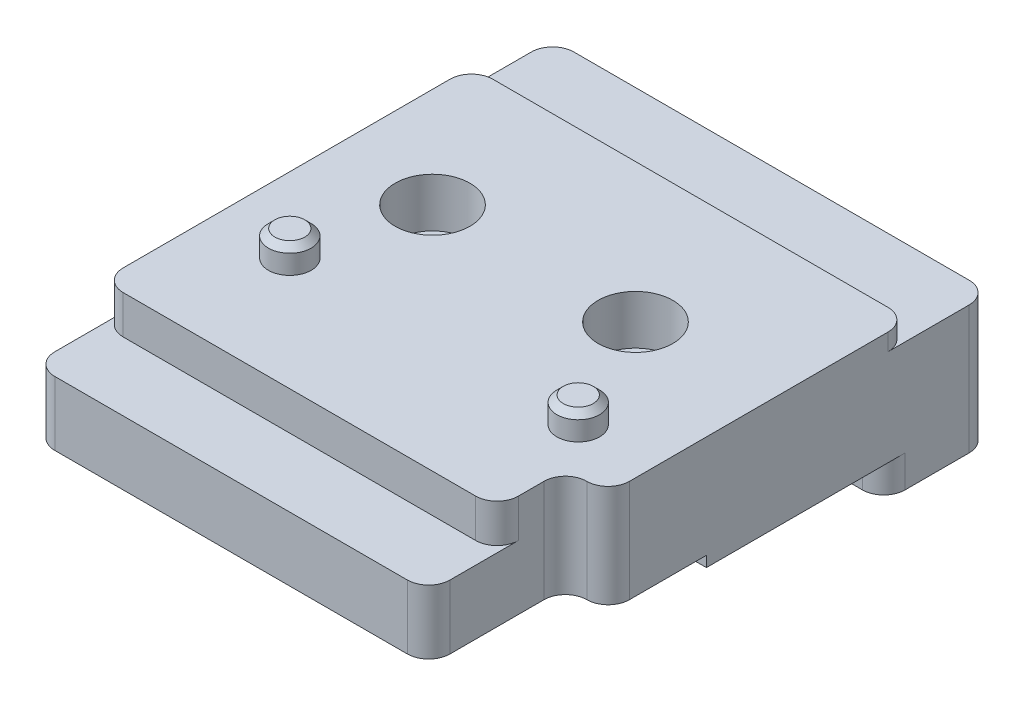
SolidWorks part; units mm, degrees
ref_plane "前视基准面" through (0, 0, 0) normal (0, 0, 1) x (1, 0, 0)
ref_plane "上视基准面" through (0, 0, 0) normal (0, 1, 0) x (1, 0, 0)
ref_plane "右视基准面" through (0, 0, 0) normal (1, 0, 0) x (0, 0, -1)
sketch "草图1" plane through (0, 0, 0) normal (0, 1, 0) x (1, 0, 0)
  line L0 (0, 0) -> (0, 11.17) construction
  line L1 (-12.75, 2.5) -> (-2.5, 2.5)
  line L2 (-12.75, 2.5) -> (-12.75, -2.5)
  line L3 (-12.75, -2.5) -> (12.75, -2.5)
  line L4 (12.75, 2.5) -> (12.75, -2.5)
  line L5 (-12.75, 2.5) -> (12.75, -2.5) construction
  line L6 (-12.75, -2.5) -> (12.75, 2.5) construction
  line L7 (2.5, 2.5) -> (12.75, 2.5)
  line L9 (-2.5, 2.5) -> (-2.5, 7)
  line L10 (-2.5, 7) -> (2.5, 7)
  line L11 (2.5, 2.5) -> (2.5, 7)
  point P0 (0, 0)
  dimension "D1" = 25.5
  dimension "D2" = 5
  dimension "D3" = 2.5
  dimension "D4" = 2.5
  dimension "D5" = 4.5
extrude "凸台-拉伸1" add sketch "草图1" along normal blind 2.5
sketch "草图3" plane through (0, 0, 0) normal (0, -1, 0) x (1, 0, 0)
  line L0 (2.5, -7) -> (-2.5, -7) construction
  line L1 (-2.5, -7) -> (-2.5, -2.5) construction
  circle A0 centre (0, -5) radius 1.15
  dimension "D1" = 2.3
  dimension "D3" = 2.5
  dimension "D2" = 2
extrude "切除-拉伸2" cut sketch "草图3" against normal through all
sketch "草图4" plane through (0, 0, 2.5) normal (0, 0, 1) x (1, 0, 0)
  line L4 (-12.75, 0) -> (12.75, 0)
  line L5 (12.75, 0) -> (12.75, 2.5)
  line L6 (12.75, 2.5) -> (-12.75, 2.5)
  line L7 (-12.75, 2.5) -> (-12.75, 0)
  line L8 (-12.75, 0) -> (12.75, 0)
  line L9 (12.75, 0) -> (12.75, 2.5)
  line L10 (12.75, 2.5) -> (-12.75, 2.5)
  line L11 (-12.75, 2.5) -> (-12.75, 0)
  dimension "D1" = 0
extrude "凸台-拉伸2" add sketch "草图4" along normal blind 16.7
sketch "草图5" plane through (0, 0, -2.5) normal (0, 0, -1) x (-1, 0, 0)
  line L0 (2.5, 2.5) -> (12.75, 2.5) construction
  line L1 (12.75, 0) -> (13.75, 0)
  line L2 (12.75, 0) -> (12.75, 2.5)
  line L3 (12.75, 2.5) -> (13.75, 2.5)
  line L4 (13.75, 0) -> (13.75, 2.5)
  line L5 (-12.75, 0) -> (-13.75, 0)
  line L6 (-12.75, 0) -> (-12.75, 2.5)
  line L7 (-12.75, 2.5) -> (-13.75, 2.5)
  line L8 (-13.75, 0) -> (-13.75, 2.5)
  line L9 (-12.75, 2.5) -> (-2.5, 2.5) construction
  dimension "D1" = 1
  dimension "D2" = 1
extrude "凸台-拉伸3" add sketch "草图5" against normal up to surface (21.7 mm away)
sketch "草图6" plane through (0, 0, 0) normal (0, -1, 0) x (1, 0, 0)
  line L1 (-13.75, -2.5) -> (-12.45, -2.5)
  line L2 (-13.75, -2.5) -> (-13.75, 1.7905)
  line L3 (-13.75, 1.7905) -> (-12.45, 1.7905)
  line L4 (-12.45, -2.5) -> (-12.45, 1.7905)
extrude "切除-拉伸3" cut sketch "草图6" against normal through all
sketch "草图7" plane through (0, 2.5, 0) normal (0, 1, 0) x (1, 0, 0)
  line L13 (13.75, 2.5) -> (2.5, 2.5)
  line L14 (2.5, 2.5) -> (2.5, 7)
  line L15 (2.5, 7) -> (-2.5, 7)
  line L16 (-2.5, 7) -> (-2.5, 2.5)
  line L17 (-2.5, 2.5) -> (-12.45, 2.5)
  line L18 (-12.45, 2.5) -> (-12.45, -1.7905)
  line L19 (-12.45, -1.7905) -> (-13.75, -1.7905)
  line L20 (-13.75, -1.7905) -> (-13.75, -19.2)
  line L21 (-13.75, -19.2) -> (13.75, -19.2)
  line L22 (13.75, -19.2) -> (13.75, 2.5)
  line L25 (13.75, 2.5) -> (2.5, 2.5)
  line L26 (2.5, 2.5) -> (2.5, 7)
  line L27 (2.5, 7) -> (-2.5, 7)
  line L28 (-2.5, 7) -> (-2.5, 2.5)
  line L29 (-2.5, 2.5) -> (-12.45, 2.5)
  line L30 (-12.45, 2.5) -> (-12.45, -1.7905)
  line L31 (-12.45, -1.7905) -> (-13.75, -1.7905)
  line L32 (-13.75, -1.7905) -> (-13.75, -19.2)
  line L33 (-13.75, -19.2) -> (13.75, -19.2)
  line L34 (13.75, -19.2) -> (13.75, 2.5)
  circle A0 centre (0, 5) radius 1.15 construction
  circle A1 centre (0, 5) radius 1.15
  dimension "D1" = 0
extrude "凸台-拉伸4" add sketch "草图7" along normal blind 2.1
sketch "草图11" plane through (0, 0, 0) normal (0, -1, 0) x (-1, 0, 0)
  line L0 (-13.75, -19.2) -> (-13.75, 2.5) construction
  line L1 (13.75, -19.2) -> (-13.75, -19.2)
  line L2 (13.75, -19.2) -> (13.75, -8.2)
  line L3 (13.75, -8.2) -> (-13.75, -8.2)
  line L4 (-13.75, -19.2) -> (-13.75, -8.2)
  dimension "D1" = 11
extrude "切除-拉伸6" cut sketch "草图11" against normal blind 2
sketch "草图12" plane through (0, 2, 0) normal (0, -1, 0) x (1, 0, 0)
  line L0 (2.6435, 10.2047) -> (-5.9829, 18.8314)
  line L1 (-6.69, 18.8314) -> (-7.6092, 17.9122)
  line L2 (-7.6092, 17.2051) -> (1.0171, 8.5784)
  line L3 (1.7242, 8.5784) -> (2.6435, 9.4976)
  line L16 (12.4735, 10.2047) -> (3.8471, 18.8314)
  line L17 (3.14, 18.8314) -> (2.2208, 17.9122)
  line L18 (2.2208, 17.2051) -> (10.8471, 8.5784)
  line L19 (11.5542, 8.5784) -> (12.4735, 9.4976)
  arc A0 (-5.9829, 18.8314) -> (-6.69, 18.8314) centre (-6.3365, 18.4779) ccw
  arc A1 (-7.6092, 17.2051) -> (-7.6092, 17.9122) centre (-7.2557, 17.5587) cw
  arc A2 (2.6435, 9.4976) -> (2.6435, 10.2047) centre (2.2899, 9.8512) ccw
  arc A3 (1.7242, 8.5784) -> (1.0171, 8.5784) centre (1.3707, 8.9319) cw
  arc A4 (3.8471, 18.8314) -> (3.14, 18.8314) centre (3.4935, 18.4779) ccw
  arc A5 (2.2208, 17.2051) -> (2.2208, 17.9122) centre (2.5743, 17.5587) cw
  arc A6 (12.4735, 9.4976) -> (12.4735, 10.2047) centre (12.1199, 9.8512) ccw
  arc A7 (11.5542, 8.5784) -> (10.8471, 8.5784) centre (11.2007, 8.9319) cw
sketch "草图13" plane through (0, 0, 0) normal (0, -1, 0) x (1, 0, 0)
  line L1 (2.5, -7) -> (-2.5, -7)
  line L2 (2.5, -7) -> (2.5, -2.5)
  line L3 (2.5, -2.5) -> (-2.5, -2.5)
  line L4 (-2.5, -7) -> (-2.5, -2.5)
extrude "切除-拉伸8" cut sketch "草图13" against normal blind 2
fillet "圆角2" radius 2 4 edges at (-2.5, 3.3, -2.5) (2.5, 3.3, -2.5) (-2.5, 3.3, -7) (2.5, 3.3, -7)
fillet "圆角3" radius 1 1 edges at (13.75, 3.3, 19.2)
sketch "草图15" plane through (0, 2, 0) normal (0, -1, 0) x (1, 0, 0)
  line L0 (13.75, 8.2) -> (13.75, 18.2) construction
  line L1 (12.75, 19.2) -> (-13.75, 19.2) construction
  circle A0 centre (11.05, 16.5) radius 1.15
  dimension "D1" = 2.3
  dimension "D2" = 2.7
  dimension "D3" = 2.7
extrude "切除-拉伸9" cut sketch "草图15" against normal through all
sketch "草图16" plane through (0, 4.6, 0) normal (0, 1, 0) x (1, 0, 0)
  line L0 (0, 5) -> (0, -20.6564) construction
  line L1 (-5, -19.2) -> (5, -19.2) construction
  line L2 (-13.75, -19.2) -> (12.75, -19.2) construction
  line L3 (-5, -17.7) -> (5, -17.7)
  line L4 (-5, -20.7) -> (5, -20.7)
  arc A0 (-5, -17.7) -> (-5, -20.7) centre (-5, -19.2) ccw
  arc A1 (5, -20.7) -> (5, -17.7) centre (5, -19.2) ccw
  point P8 (0, -19.2)
  dimension "D1" = 1.5
  dimension "D2" = 5
extrude "切除-拉伸10" cut sketch "草图16" against normal blind 1
sketch "草图18" plane through (0, 2, 0) normal (0, -1, 0) x (1, 0, 0)
  line L4 (-2.5, -4.5) -> (-2.5, -5)
  line L5 (-0.5, -7) -> (0.5, -7)
  line L6 (2.5, -5) -> (2.5, -4.5)
  line L7 (4.5, -2.5) -> (-4.5, -2.5)
  line L8 (-2.5, -4.5) -> (-2.5, -5)
  line L9 (-0.5, -7) -> (0.5, -7)
  line L10 (2.5, -5) -> (2.5, -4.5)
  line L11 (4.5, -2.5) -> (-4.5, -2.5)
  arc A4 (-2.5, -5) -> (-0.5, -7) centre (-0.5, -5) ccw
  arc A5 (0.5, -7) -> (2.5, -5) centre (0.5, -5) ccw
  arc A6 (4.5, -2.5) -> (2.5, -4.5) centre (4.5, -4.5) ccw
  arc A7 (-2.5, -4.5) -> (-4.5, -2.5) centre (-4.5, -4.5) ccw
  arc A8 (-2.5, -5) -> (-0.5, -7) centre (-0.5, -5) ccw
  arc A9 (0.5, -7) -> (2.5, -5) centre (0.5, -5) ccw
  arc A10 (4.5, -2.5) -> (2.5, -4.5) centre (4.5, -4.5) ccw
  arc A11 (-2.5, -4.5) -> (-4.5, -2.5) centre (-4.5, -4.5) ccw
  dimension "D1" = 0
extrude "切除-拉伸11" cut sketch "草图18" against normal through all
extrude "切除-拉伸12" cut sketch "草图12" against normal blind 1
sketch "草图19" plane through (0, 0, 0) normal (0, -1, 0) x (1, 0, 0)
  line L0 (13.75, -2.5) -> (-12.45, -2.5) construction
  line L1 (-13.75, 19.2) -> (-8.75, 19.2)
  line L2 (-13.75, 19.2) -> (-13.75, -2.5)
  line L3 (-13.75, -2.5) -> (-8.75, -2.5)
  line L4 (-8.75, 19.2) -> (-8.75, -2.5)
  dimension "D1" = 5
extrude "切除-拉伸13" cut sketch "草图19" against normal through all
sketch "草图24" plane through (0, 2, 0) normal (0, -1, 0) x (1, 0, 0)
  line L4 (12.75, 19.2) -> (-8.75, 19.2)
  line L5 (-8.75, 19.2) -> (-8.75, 8.2)
  line L6 (-8.75, 8.2) -> (13.75, 8.2)
  line L7 (13.75, 8.2) -> (13.75, 18.2)
  line L8 (12.75, 19.2) -> (-8.75, 19.2)
  line L9 (-8.75, 19.2) -> (-8.75, 8.2)
  line L10 (-8.75, 8.2) -> (13.75, 8.2)
  line L11 (13.75, 8.2) -> (13.75, 18.2)
  arc A3 (13.75, 18.2) -> (12.75, 19.2) centre (12.75, 18.2) ccw
  arc A5 (13.75, 18.2) -> (12.75, 19.2) centre (12.75, 18.2) ccw
  dimension "D1" = 0
extrude "切除-拉伸18" cut sketch "草图24" against normal through all
sketch "草图25" plane through (0, 0, 0) normal (0, -1, 0) x (1, 0, 0)
  line L0 (13.75, 8.2) -> (13.75, -2.5) construction
  line L1 (-8.75, 8.2) -> (13.75, 8.2)
  line L2 (-8.75, 8.2) -> (-8.75, 6.2)
  line L3 (-8.75, 6.2) -> (13.75, 6.2)
  line L4 (13.75, 8.2) -> (13.75, 6.2)
  dimension "D1" = 2
extrude "切除-拉伸19" cut sketch "草图25" against normal blind 1.5
sketch "草图31" plane through (-8.75, 0, 0) normal (-1, 0, 0) x (0, 0, 1)
  line L6 (-2.5, 0) -> (6.2, 0)
  line L7 (6.2, 0) -> (6.2, 1.5)
  line L8 (6.2, 1.5) -> (8.2, 1.5)
  line L9 (8.2, 1.5) -> (8.2, 4.6)
  line L10 (8.2, 4.6) -> (-2.5, 4.6)
  line L11 (-2.5, 4.6) -> (-2.5, 0)
  line L12 (-2.5, 0) -> (6.2, 0)
  line L13 (6.2, 0) -> (6.2, 1.5)
  line L14 (6.2, 1.5) -> (8.2, 1.5)
  line L15 (8.2, 1.5) -> (8.2, 4.6)
  line L16 (8.2, 4.6) -> (-2.5, 4.6)
  line L17 (-2.5, 4.6) -> (-2.5, 0)
  dimension "D1" = 0
extrude "切除-拉伸22" cut sketch "草图31" against normal blind 2
sketch "草图32" plane through (0, 0, 8.2) normal (0, 0, 1) x (1, 0, 0)
  line L4 (-6.75, 4.6) -> (-6.75, 1.5)
  line L5 (-6.75, 1.5) -> (13.75, 1.5)
  line L6 (13.75, 1.5) -> (13.75, 4.6)
  line L7 (13.75, 4.6) -> (-6.75, 4.6)
  line L8 (-6.75, 4.6) -> (-6.75, 1.5)
  line L9 (-6.75, 1.5) -> (13.75, 1.5)
  line L10 (13.75, 1.5) -> (13.75, 4.6)
  line L11 (13.75, 4.6) -> (-6.75, 4.6)
  dimension "D1" = 0
extrude "凸台-拉伸6" add sketch "草图32" along normal blind 10.9
sketch "草图34" plane through (0, 1.5, 0) normal (0, -1, 0) x (1, 0, 0)
  line L1 (13.75, 19.1) -> (11.75, 19.1)
  line L2 (13.75, 19.1) -> (13.75, 12.6)
  line L3 (13.75, 12.6) -> (11.75, 12.6)
  line L4 (11.75, 19.1) -> (11.75, 12.6)
  dimension "D1" = 2
  dimension "D2" = 6.5
extrude "切除-拉伸23" cut sketch "草图34" against normal through all
sketch "草图17" plane through (0, 4.6, 0) normal (0, 1, 0) x (1, 0, 0)
  line L4 (13.75, -12.6) -> (13.75, 2.5) construction
  line L7 (-6.75, -19.1) -> (-6.75, 2.5) construction
  line L8 (13.75, 2.5) -> (-6.75, 2.5) construction
  circle A0 centre (10.25, -10.5) radius 1
  circle A1 centre (-3.25, -10.5) radius 1
  dimension "D2" = 3.5
  dimension "D3" = 3.5
  dimension "D4" = 13
  dimension "D1" = 2
  dimension "D5" = 13
extrude "凸台-拉伸8" add sketch "草图17" along normal blind 1.5
sketch "草图39" plane through (0, 4.6, 0) normal (0, 1, 0) x (1, 0, 0)
  line L6 (-6.75, -19.1) -> (11.75, -19.1)
  line L7 (-6.75, -19.1) -> (11.75, -19.1)
  line L8 (11.75, -12.6) -> (13.75, -12.6)
  line L9 (11.75, -19.1) -> (11.75, -12.6)
  line L10 (13.75, -12.6) -> (13.75, 2.5)
  line L11 (11.75, -12.6) -> (13.75, -12.6)
  line L12 (13.75, 2.5) -> (-6.75, 2.5)
  line L13 (-6.75, 2.5) -> (-6.75, -19.1)
  line L16 (11.75, -19.1) -> (11.75, -12.6)
  line L17 (13.75, -12.6) -> (13.75, 2.5)
  line L19 (13.75, 2.5) -> (-6.75, 2.5)
  line L20 (-6.75, 2.5) -> (-6.75, -19.1)
  dimension "D1" = 0
extrude "凸台-拉伸9" add sketch "草图39" along normal blind 0.5
chamfer "倒角3" distance 0.3 angle 45 2 edges at (-3.25, 6.1, 11.5) (10.25, 6.1, 11.5)
sketch "草图42" plane through (0, 5.1, 0) normal (0, 1, 0) x (1, 0, 0)
  line L1 (13.75, 2.5) -> (1.25, 2.5)
  line L2 (13.75, 2.5) -> (13.75, 5.8)
  line L3 (13.75, 5.8) -> (1.25, 5.8)
  line L4 (1.25, 2.5) -> (1.25, 5.8)
  dimension "D1" = 3.3
  dimension "D2" = 12.5
extrude "凸台-拉伸10" add sketch "草图42" against normal blind 3.6
sketch "草图43" plane through (0, 1.5, 0) normal (0, -1, 0) x (1, 0, 0)
  line L0 (1.25, -5.8) -> (1.25, -2.5) construction
  line L1 (13.75, -5.8) -> (1.25, -5.8)
  line L2 (13.75, -5.8) -> (13.75, -0.3)
  line L3 (13.75, -0.3) -> (1.25, -0.3)
  line L4 (1.25, -5.8) -> (1.25, -0.3)
  dimension "D1" = 5.5
extrude "凸台-拉伸11" add sketch "草图43" along normal blind 3.4
sketch "草图44" plane through (0, 0, -0.3) normal (0, 0, 1) x (1, 0, 0)
  line L0 (13.75, -1.9) -> (1.25, -1.9) construction
  line L1 (10.3099, -1.9) -> (3.3817, -1.9) construction
  arc A0 (10.3099, -1.9) -> (3.3817, -1.9) centre (6.8458, -2.4) ccw construction
  arc A1 (10.3099, -1.9) -> (3.3817, -1.9) centre (6.8458, -2.4) ccw construction
  circle A2 centre (6.8458, -2.4) radius 3.5
  dimension "D1" = 7
extrude "切除-拉伸29" cut sketch "草图44" against normal through all
sketch "草图45" plane through (0, -1.9, 0) normal (0, -1, 0) x (1, 0, 0)
  line L0 (6.8458, -5.3) -> (6.8458, 4.2448) construction
  line L1 (3.3817, -5.8) -> (10.3099, -5.8) construction
  line L2 (3.3817, -2.55) -> (15.5121, -2.55) construction
  line L4 (6.8458, -4.05) -> (6.8458, -1.05) construction
  line L5 (6.3458, -4.05) -> (6.3458, -1.05)
  line L6 (7.3458, -4.05) -> (7.3458, -1.05)
  arc A0 (6.3458, -4.05) -> (7.3458, -4.05) centre (6.8458, -4.05) ccw
  arc A1 (7.3458, -1.05) -> (6.3458, -1.05) centre (6.8458, -1.05) ccw
  point P10 (6.8458, -2.55)
  dimension "D1" = 0.5
  dimension "D2" = 1.5
  dimension "D3" = 1.5
  dimension "D4" = 3.25
extrude "切除-拉伸30" cut sketch "草图45" against normal blind 3.4
sketch "草图46" plane through (0, 5.1, 0) normal (0, 1, 0) x (1, 0, 0)
  line L1 (1.2465, 2.5) -> (14.0985, 2.5)
  line L2 (1.2465, 2.5) -> (1.2465, 7.0964)
  line L3 (1.2465, 7.0964) -> (14.0985, 7.0964)
  line L4 (14.0985, 2.5) -> (14.0985, 7.0964)
extrude "切除-拉伸32" cut sketch "草图46" against normal blind 1
sketch "草图47" plane through (0, 1.5, 0) normal (0, -1, 0) x (1, 0, 0)
  line L5 (13.75, 6.2) -> (13.75, 12.6)
  line L6 (11.75, 12.6) -> (11.75, 19.1)
  line L7 (11.75, 19.1) -> (-6.75, 19.1)
  line L8 (-6.75, 19.1) -> (-6.75, 6.2)
  line L9 (-6.75, 6.2) -> (13.75, 6.2)
  line L10 (13.75, 6.2) -> (13.75, 12.6)
  line L11 (11.75, 12.6) -> (11.75, 19.1)
  line L12 (11.75, 19.1) -> (-6.75, 19.1)
  line L13 (-6.75, 19.1) -> (-6.75, 6.2)
  line L14 (-6.75, 6.2) -> (13.75, 6.2)
  line L16 (13.75, 12.6) -> (11.75, 12.6)
  line L17 (13.75, 12.6) -> (11.75, 12.6)
  dimension "D1" = 0
extrude "凸台-拉伸12" add sketch "草图47" along normal blind 1.9
sketch "草图49" plane through (0, -0.4, 0) normal (0, -1, 0) x (-1, 0, 0)
  line L0 (-10.3888, -9.8577) -> (-11.7926, -11.2615) construction
  line L1 (-11.7926, -11.2615) -> (-4.7221, -18.332) construction
  line L2 (-4.7221, -18.332) -> (-3.3183, -16.9282) construction
  line L3 (-3.3183, -16.9282) -> (-10.3888, -9.8577) construction
  line L4 (-1.2211, -9.152) -> (-2.0017, -9.9326) construction
  line L5 (-2.0017, -9.9326) -> (5.0788, -17.0131) construction
  line L6 (5.0788, -17.0131) -> (5.8595, -16.2325) construction
  line L7 (5.8595, -16.2325) -> (-1.2211, -9.152) construction
  line L8 (-10.3888, -9.0092) -> (-12.6411, -11.2615)
  line L9 (-12.6411, -11.2615) -> (-5.2524, -18.6502)
  line L10 (-4.1918, -18.6502) -> (-2.4698, -16.9282)
  line L11 (-2.4698, -16.9282) -> (-10.3888, -9.0092)
  line L12 (-1.2211, -8.3034) -> (-2.8503, -9.9326)
  line L13 (-2.8503, -9.9326) -> (5.0788, -17.8617)
  line L14 (5.0788, -17.8617) -> (6.708, -16.2325)
  line L15 (6.708, -16.2325) -> (-1.2211, -8.3034)
  line L16 (-12.6411, -11.2615) -> (-4.7221, -19.1806) construction
  line L17 (-4.7221, -19.1806) -> (-2.4698, -16.9282) construction
  arc A0 (-5.2524, -18.6502) -> (-4.1918, -18.6502) centre (-4.7221, -18.1199) ccw
  dimension "D2" = 0.75
  dimension "D1" = 0.6
extrude "切除-拉伸34" cut sketch "草图49" against normal blind 1
sketch "草图50" plane through (0, 0, 0) normal (0, -1, 0) x (1, 0, 0)
  line L8 (9.3934, -0.3) -> (13.75, -0.3)
  line L9 (13.75, -0.3) -> (13.75, 6.2)
  line L10 (13.75, 6.2) -> (-6.75, 6.2)
  line L11 (-6.75, 6.2) -> (-6.75, -2.5)
  line L12 (-6.75, -2.5) -> (1.25, -2.5)
  line L13 (1.25, -2.5) -> (1.25, -0.3)
  line L14 (1.25, -0.3) -> (4.2983, -0.3)
  line L15 (4.2983, -0.3) -> (9.3934, -0.3)
  line L16 (9.3934, -0.3) -> (13.75, -0.3)
  line L17 (13.75, -0.3) -> (13.75, 6.2)
  line L18 (13.75, 6.2) -> (-6.75, 6.2)
  line L19 (-6.75, 6.2) -> (-6.75, -2.5)
  line L20 (-6.75, -2.5) -> (1.25, -2.5)
  line L21 (1.25, -2.5) -> (1.25, -0.3)
  line L22 (1.25, -0.3) -> (4.2983, -0.3)
  line L23 (4.2983, -0.3) -> (9.3934, -0.3)
  dimension "D1" = 0
extrude "凸台-拉伸13" add sketch "草图50" along normal up to surface (0.4 mm away)
sketch "草图51" plane through (0, 0, -2.5) normal (0, 0, -1) x (-1, 0, 0)
  line L6 (6.75, -0.4) -> (6.75, 5.1)
  line L7 (6.75, 5.1) -> (-13.75, 5.1)
  line L8 (-13.75, 5.1) -> (-13.75, 4.1)
  line L9 (-13.75, 4.1) -> (-1.25, 4.1)
  line L10 (-1.25, 4.1) -> (-1.25, -0.4)
  line L11 (-1.25, -0.4) -> (6.75, -0.4)
  line L12 (6.75, -0.4) -> (6.75, 5.1)
  line L13 (6.75, 5.1) -> (-13.75, 5.1)
  line L14 (-13.75, 5.1) -> (-13.75, 4.1)
  line L15 (-13.75, 4.1) -> (-1.25, 4.1)
  line L16 (-1.25, 4.1) -> (-1.25, -0.4)
  line L17 (-1.25, -0.4) -> (6.75, -0.4)
  dimension "D1" = 0
extrude "切除-拉伸35" cut sketch "草图51" against normal blind 1
sketch "草图52" plane through (0, 0, -0.3) normal (0, 0, -1) x (-1, 0, 0)
  line L1 (-9.7181, -0.4) -> (-3.9736, -0.4)
  line L2 (-9.7181, -0.4) -> (-3.9736, -0.4)
  arc A1 (-3.9736, -0.4) -> (-9.7181, -0.4) centre (-6.8458, -2.4) ccw
  arc A2 (-3.9736, -0.4) -> (-9.7181, -0.4) centre (-6.8458, -2.4) ccw
  dimension "D1" = 0
extrude "切除-拉伸36" cut sketch "草图52" against normal blind 2
fillet "圆角11" radius 0.75 7 edges at (2.4698, 0.1, 16.9282) (12.6411, 0.1, 11.2615) (10.3888, 0.1, 9.0092) (2.8503, 0.1, 9.9326) (1.2211, 0.1, 8.3034) (-5.0788, 0.1, 17.8617) (-6.708, 0.1, 16.2325)
sketch "草图55" plane through (0, 0, 19.1) normal (0, 0, 1) x (1, 0, 0)
  line L4 (11.75, -0.4) -> (11.75, 5.1)
  line L5 (11.75, 5.1) -> (-6.75, 5.1)
  line L6 (-6.75, 5.1) -> (-6.75, -0.4)
  line L7 (-6.75, -0.4) -> (11.75, -0.4)
  line L8 (11.75, -0.4) -> (11.75, 5.1)
  line L9 (11.75, 5.1) -> (-6.75, 5.1)
  line L10 (-6.75, 5.1) -> (-6.75, -0.4)
  line L11 (-6.75, -0.4) -> (11.75, -0.4)
  dimension "D1" = 0
extrude "切除-拉伸39" cut sketch "草图55" against normal blind 0.1
fillet "圆角8" radius 1 4 edges at (13.75, 2.35, 12.6) (11.75, 2.35, 12.6) (11.75, 2.35, 19) (-6.75, 2.35, 19)
sketch "草图54" plane through (0, 5.1, 0) normal (0, 1, 0) x (1, 0, 0)
  line L0 (11.75, -15.8) -> (-6.75, -15.8)
  line L5 (13.75, 1.5) -> (-6.75, 1.5)
  line L6 (-6.75, 1.5) -> (-6.75, -18)
  line L7 (-5.75, -19) -> (10.75, -19)
  line L8 (11.75, -18) -> (11.75, -13.6)
  line L9 (13.75, -11.6) -> (13.75, 1.5)
  line L11 (-6.75, -15.8) -> (-6.75, -18)
  line L12 (-5.75, -19) -> (10.75, -19)
  line L13 (11.75, -18) -> (11.75, -15.8)
  arc A6 (10.75, -19) -> (11.75, -18) centre (10.75, -18) ccw
  arc A7 (10.75, -19) -> (11.75, -18) centre (10.75, -18) ccw
  arc A8 (-6.75, -18) -> (-5.75, -19) centre (-5.75, -18) ccw
  arc A9 (-6.75, -18) -> (-5.75, -19) centre (-5.75, -18) ccw
  arc A10 (12.75, -12.6) -> (11.75, -13.6) centre (12.75, -13.6) ccw
  arc A11 (12.75, -12.6) -> (13.75, -11.6) centre (12.75, -11.6) ccw
  dimension "D1" = 0
extrude "切除-拉伸38" cut sketch "草图54" against normal blind 2
fillet "圆角12" radius 1 2 edges at (-6.75, 4.1, 15.8) (11.75, 4.1, 15.8)
hole_wizard "打孔尺寸(%根据)内六角圆柱头螺钉的类型0" positions "草图56" profile "草图57" counterbore size "M2" standard "GB"
sketch "草图56" plane through (0, -0.4, 0) normal (0, -1, 0) x (-1, 0, 0)
  point P0 (2.07, -4.9998)
  point P2 (-7.43, -4.9998)
sketch "草图57" plane through (-2.07, -0.4, 4.9998) normal (1, 0, 0) x (0, 0, -1)
  line L0 (0, 0) -> (0, 6.6609)
  line L1 (0, 6.6609) -> (1.1, 6)
  line L2 (1.1, 6) -> (1.1, 2.3)
  line L3 (1.1, 2.3) -> (2, 2.3)
  line L4 (2, 2.3) -> (2, 0)
  line L5 (2, 0) -> (0, 0)
  line L10 (0, 6.6609) -> (-1.1, 6) construction
  line L11 (0, -6.35) -> (0, 107.95) construction
  dimension "孔直径" = 2.2
  dimension "孔深度" = 6
  dimension "柱形沉头孔直径" = 4
  dimension "柱形沉头孔深度" = 2.3
  dimension "导头角度" = 118
sketch "草图58" plane through (0, 5.1, 0) normal (0, 1, 0) x (1, 0, 0)
  circle A0 centre (7.43, -4.9998) radius 1.75
  circle A1 centre (-2.07, -4.9998) radius 1.75
  dimension "D1" = 3.5
  dimension "D2" = 3.5
extrude "切除-拉伸40" cut sketch "草图58" against normal blind 2.5
sketch "草图59" plane through (0, 5.1, 0) normal (0, 1, 0) x (1, 0, 0)
  line L5 (-6.75, 1.5) -> (-6.75, -14.8)
  line L6 (-5.75, -15.8) -> (10.75, -15.8)
  line L7 (11.75, -14.8) -> (11.75, -13.6)
  line L8 (13.75, -11.6) -> (13.75, 1.5)
  line L9 (13.75, 1.5) -> (-6.75, 1.5)
  line L10 (-6.75, 1.5) -> (-6.75, -14.8)
  line L11 (-5.75, -15.8) -> (10.75, -15.8)
  line L12 (11.75, -14.8) -> (11.75, -13.6)
  line L13 (13.75, -11.6) -> (13.75, 1.5)
  line L14 (13.75, 1.5) -> (-6.75, 1.5)
  circle A0 centre (-3.25, -10.5) radius 1 construction
  circle A1 centre (10.25, -10.5) radius 1 construction
  circle A2 centre (-3.25, -10.5) radius 1
  circle A3 centre (10.25, -10.5) radius 1
  arc A5 (-6.75, -14.8) -> (-5.75, -15.8) centre (-5.75, -14.8) ccw
  arc A6 (10.75, -15.8) -> (11.75, -14.8) centre (10.75, -14.8) ccw
  arc A7 (12.75, -12.6) -> (11.75, -13.6) centre (12.75, -13.6) ccw
  arc A8 (12.75, -12.6) -> (13.75, -11.6) centre (12.75, -11.6) ccw
  arc A10 (-6.75, -14.8) -> (-5.75, -15.8) centre (-5.75, -14.8) ccw
  arc A11 (10.75, -15.8) -> (11.75, -14.8) centre (10.75, -14.8) ccw
  arc A12 (12.75, -12.6) -> (11.75, -13.6) centre (12.75, -13.6) ccw
  arc A13 (12.75, -12.6) -> (13.75, -11.6) centre (12.75, -11.6) ccw
  dimension "D1" = 0
extrude "切除-拉伸41" cut sketch "草图59" against normal blind 0.2
sketch "草图60" plane through (0, 0, -5.8) normal (0, 0, -1) x (-1, 0, 0)
  line L5 (-1.25, 4.1) -> (-13.75, 4.1)
  line L6 (-13.75, 4.1) -> (-13.75, -1.9)
  line L7 (-13.75, -1.9) -> (-10.3099, -1.9)
  line L8 (-3.3817, -1.9) -> (-1.25, -1.9)
  line L9 (-1.25, -1.9) -> (-1.25, 4.1)
  line L10 (-1.25, 4.1) -> (-13.75, 4.1)
  line L11 (-13.75, 4.1) -> (-13.75, -1.9)
  line L12 (-13.75, -1.9) -> (-10.3099, -1.9)
  line L13 (-3.3817, -1.9) -> (-1.25, -1.9)
  line L14 (-1.25, -1.9) -> (-1.25, 4.1)
  arc A1 (-3.3817, -1.9) -> (-10.3099, -1.9) centre (-6.8458, -2.4) ccw
  arc A2 (-3.3817, -1.9) -> (-10.3099, -1.9) centre (-6.8458, -2.4) ccw
  dimension "D1" = 0
extrude "切除-拉伸42" cut sketch "草图60" against normal blind 0.5
fillet "圆角10" radius 1 3 edges at (13.75, -1.15, -0.3) (13.75, 4.5, -1.5) (13.75, 1.1, -5.3)
sketch "草图61" plane through (0, -0.4, 0) normal (0, -1, 0) x (1, 0, 0)
  line L0 (13.75, -1.3) -> (13.75, 11.6) construction
  line L1 (13.75, 8) -> (-6.9757, 8)
  line L2 (13.75, 8) -> (13.75, 19.0325)
  line L3 (13.75, 19.0325) -> (-6.9757, 19.0325)
  line L4 (-6.9757, 8) -> (-6.9757, 19.0325)
  line L5 (-5.75, 19) -> (10.75, 19) construction
  dimension "D1" = 11
extrude "切除-拉伸43" cut sketch "草图61" against normal blind 1
sketch "草图62" plane through (0, 0.6, 0) normal (0, -1, 0) x (1, 0, 0)
  line L5 (11.75, 13.6) -> (11.75, 18)
  line L6 (10.75, 19) -> (-5.75, 19)
  line L7 (-6.75, 18) -> (-6.75, 8)
  line L8 (-6.75, 8) -> (13.75, 8)
  line L9 (13.75, 8) -> (13.75, 11.6)
  line L10 (11.75, 13.6) -> (11.75, 18)
  line L11 (10.75, 19) -> (-5.75, 19)
  line L12 (-6.75, 18) -> (-6.75, 8)
  line L13 (-6.75, 8) -> (13.75, 8)
  line L14 (13.75, 8) -> (13.75, 11.6)
  arc A4 (11.75, 13.6) -> (12.75, 12.6) centre (12.75, 13.6) ccw
  arc A5 (11.75, 18) -> (10.75, 19) centre (10.75, 18) ccw
  arc A6 (-5.75, 19) -> (-6.75, 18) centre (-5.75, 18) ccw
  arc A7 (13.75, 11.6) -> (12.75, 12.6) centre (12.75, 11.6) ccw
  arc A8 (11.75, 13.6) -> (12.75, 12.6) centre (12.75, 13.6) ccw
  arc A9 (11.75, 18) -> (10.75, 19) centre (10.75, 18) ccw
  arc A10 (-5.75, 19) -> (-6.75, 18) centre (-5.75, 18) ccw
  arc A11 (13.75, 11.6) -> (12.75, 12.6) centre (12.75, 11.6) ccw
  dimension "D1" = 0
extrude "凸台-拉伸14" add sketch "草图62" along normal blind 0.5
sketch "草图63" plane through (0, 0, -5.3) normal (0, 0, -1) x (-1, 0, 0)
  line L0 (-3.3817, -1.9) -> (-1.25, -1.9) construction
  line L1 (-1.25, 4.1) -> (6.75, 4.1)
  line L2 (-1.25, 4.1) -> (-1.25, -1.9)
  line L3 (-1.25, -1.9) -> (6.75, -1.9)
  line L4 (6.75, 4.1) -> (6.75, -1.9)
  line L5 (6.75, -0.4) -> (6.75, 4.9) construction
extrude "凸台-拉伸15" add sketch "草图63" against normal up to surface (5 mm away)
pattern_linear "阵列(线性)1" count 2 spacing 9.5 along (-1, 0, 0) of "切除-拉伸30", "切除-拉伸36"
sketch "草图64" plane through (0, 0, -5.3) normal (0, 0, -1) x (-1, 0, 0)
  circle A0 centre (-6.8458, -2.4) radius 3.5 construction
  circle A1 centre (2.6542, -2.4) radius 3.5
  dimension "D1" = 2
extrude "切除-拉伸44" cut sketch "草图64" against normal up to surface (7 mm away)
sketch "草图65" plane through (-6.75, 0, 0) normal (-1, 0, 0) x (0, 0, 1)
  line L0 (-5.3, -1.9) -> (-5.3, 4.1) construction
  line L1 (-0.3, -1.9) -> (-5.3, -1.9)
  line L2 (-0.3, -1.9) -> (-0.3, -0.4)
  line L3 (-0.3, -0.4) -> (-5.3, -0.4)
  line L4 (-5.3, -1.9) -> (-5.3, -0.4)
  line L5 (8, -0.4) -> (-0.3, -0.4) construction
extrude "凸台-拉伸16" add sketch "草图65" along normal blind 1
fillet "圆角13" radius 1 4 edges at (-6.75, 4.5, -1.5) (-6.75, 1.85, -5.3) (-7.75, -1.15, -5.3) (-7.75, -1.15, -0.3)
sketch "草图66" plane through (0, 0, 1.7) normal (0, 0, -1) x (-1, 0, 0)
  line L1 (-0.2181, -0.4) -> (5.5264, -0.4)
  line L2 (-0.2181, -0.4) -> (5.5264, -0.4)
  line L3 (-9.7181, -0.4) -> (-3.9736, -0.4)
  line L4 (-9.7181, -0.4) -> (-3.9736, -0.4)
  arc A1 (5.5264, -0.4) -> (-0.2181, -0.4) centre (2.6542, -2.4) ccw
  arc A2 (5.5264, -0.4) -> (-0.2181, -0.4) centre (2.6542, -2.4) ccw
  arc A3 (-3.9736, -0.4) -> (-9.7181, -0.4) centre (-6.8458, -2.4) ccw
  arc A4 (-3.9736, -0.4) -> (-9.7181, -0.4) centre (-6.8458, -2.4) ccw
  dimension "D1" = 0
  dimension "D2" = 0
extrude "凸台-拉伸17" add sketch "草图66" along normal blind 2
